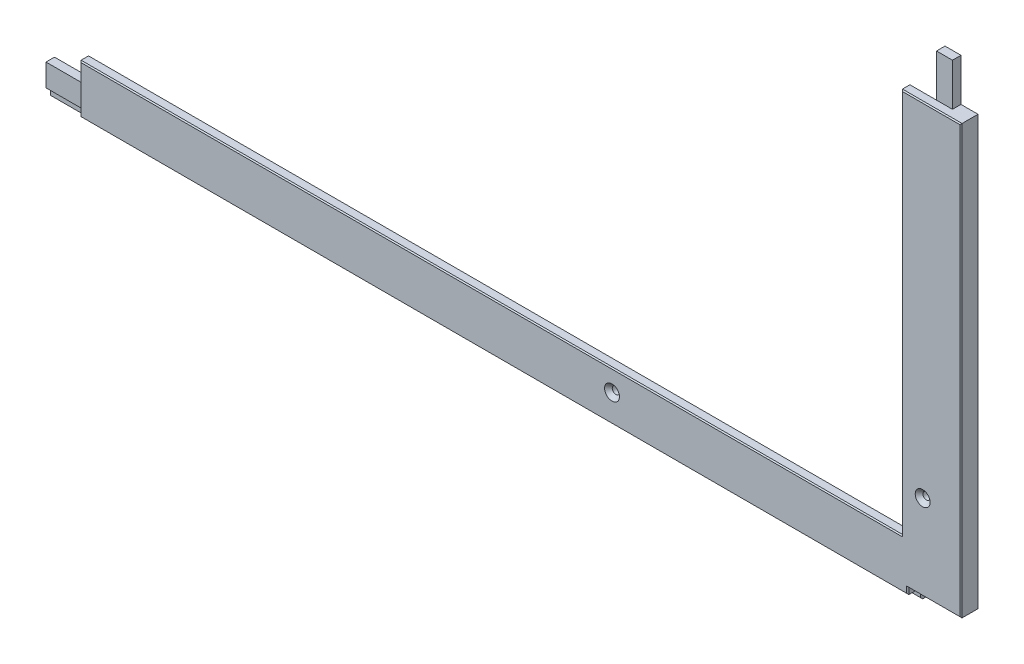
SolidWorks part; units mm, degrees
ref_plane "Ebene vorne" through (0, 0, 0) normal (0, 0, 1) x (1, 0, 0)
ref_plane "Ebene oben" through (0, 0, 0) normal (0, 1, 0) x (1, 0, 0)
ref_plane "Ebene rechts" through (0, 0, 0) normal (1, 0, 0) x (0, 0, -1)
sketch "Skizze1" plane through (0, 0, 0) normal (0, 0, 1) x (1, 0, 0)
  line L1 (-396, -191.25) -> (396, -191.25)
  line L2 (-396, -191.25) -> (-396, 191.25)
  line L3 (-396, 191.25) -> (396, 191.25)
  line L4 (396, -191.25) -> (396, 191.25)
  line L5 (-396, -191.25) -> (396, 191.25) construction
  line L6 (-396, 191.25) -> (396, -191.25) construction
  line L7 (-416, -211.25) -> (416, -211.25)
  line L8 (-416, -211.25) -> (-416, 211.25)
  line L9 (-416, 211.25) -> (416, 211.25)
  line L10 (416, -211.25) -> (416, 211.25)
  line L11 (-416, -211.25) -> (416, 211.25) construction
  line L12 (-416, 211.25) -> (416, -211.25) construction
  point P0 (0, 0)
  point P6 (0, 0)
  dimension "D1" = 832
  dimension "D2" = 422.5
  dimension "D3" = 20
  dimension "D4" = 20
extrude "Aufsatz-Linear austragen1" add sketch "Skizze1" along normal blind 8
fillet "Verrundung1" radius 1 3 edges at (-416, 211.25, 4) (-416, -211.25, 4) (416, 211.25, 4)
sketch "Skizze2" plane through (0, 0, 0) normal (0, 0, -1) x (-1, 0, 0)
  line L0 (-416, -211.25) -> (-416, 210.25) construction
  line L1 (-408.5, 203.75) -> (408.5, 203.75)
  line L2 (-408.5, 203.75) -> (-408.5, -203.75)
  line L3 (-408.5, -203.75) -> (408.5, -203.75)
  line L4 (408.5, 203.75) -> (408.5, -203.75)
  line L5 (-415, 211.25) -> (415, 211.25) construction
  line L6 (416, 210.25) -> (416, -210.25) construction
  line L7 (415, -211.25) -> (-416, -211.25) construction
  dimension "D1" = 7.5
  dimension "D2" = 7.5
  dimension "D3" = 7.5
  dimension "D4" = 7.5
extrude "Schnitt-Linear austragen1" cut sketch "Skizze2" against normal blind 4
hole_wizard "Formsenkung für M3 Senkschraube mit Innensechskant1" positions "Skizze3" profile "Skizze4" countersink size "M3" standard "DIN"
sketch "Skizze3" plane through (0, 0, 8) normal (0, 0, 1) x (1, 0, 0)
  line L0 (-416, 210.25) -> (-416, -210.25) construction
  line L1 (416, -211.25) -> (416, 210.25) construction
  line L2 (-415, -211.25) -> (416, -211.25) construction
  line L3 (415, 211.25) -> (-415, 211.25) construction
  point P0 (-260, -201.25)
  point P2 (260, -201.25)
  point P4 (260, 201.25)
  point P6 (-260, 201.25)
  point P8 (406, 171.25)
  point P10 (406, -171.25)
  point P12 (-406, -171.25)
  point P14 (-406, 171.25)
  point P26 (-406, 0)
  point P32 (406, 0)
  point P37 (0, -201.25)
  point P39 (0, 201.25)
  dimension "D1" = 156
  dimension "D2" = 156
  dimension "D3" = 10
  dimension "D4" = 10
  dimension "D5" = 10
  dimension "D6" = 10
  dimension "D7" = 40
  dimension "D8" = 40
sketch "Skizze4" plane through (-260, -201.25, 8) normal (1, 0, 0) x (0, -1, 0)
  line L0 (0, 0) -> (0, 8)
  line L1 (0, 8) -> (1.7, 8)
  line L2 (1.7, 8) -> (1.7, 1.8)
  line L3 (1.7, 1.8) -> (3.5, 0)
  line L5 (3.5, 0) -> (0, 0)
  line L6 (-1.7, 1.8) -> (-3.5, 0) construction
  line L11 (0, -6.35) -> (0, 107.95) construction
  dimension "Bohrerdurchmesser" = 3.4
  dimension "Bohrungstiefe" = 8
  dimension "Senkdurchmesser (Oben)" = 7
  dimension "Senkwinkel (Oben)" = 90
sketch "Skizze5" plane through (0, 0, 0) normal (1, 0, 0) x (0, 0, -1)
  line L0 (-8, 211.25) -> (-8, -10)
  line L1 (-8, -211.25) -> (-8, 210.25) construction
  line L2 (-8, -10) -> (-4, -10)
  line L3 (-4, -10) -> (-4, 10)
  line L4 (-4, 10) -> (0, 10)
  line L5 (0, -211.25) -> (0, 210.25) construction
  line L6 (0, 10) -> (0, 211.25)
  line L7 (0, 211.25) -> (-8, 211.25)
  dimension "D1" = 10
  dimension "D2" = 10
  dimension "D3" = 4
extrude "Schnitt-Linear austragen2" cut sketch "Skizze5" along normal through all
sketch "Skizze6" plane through (0, 0, 0) normal (1, 0, 0) x (0, 0, -1)
  line L0 (-8, 211.25) -> (-8, -10)
  line L1 (-8, -211.25) -> (-8, -10) construction
  line L2 (-8, -10) -> (-4, -10)
  line L3 (-4, -10) -> (-4, 10)
  line L4 (-4, 10) -> (0, 10)
  line L5 (0, -211.25) -> (0, 10) construction
  line L6 (0, 10) -> (0, 211.25)
  line L7 (0, 211.25) -> (-8, 211.25)
  line L8 (-8, 211.25) -> (-8, 204.75) construction
  dimension "D1" = 10
  dimension "D2" = 4
  dimension "D3" = 10
extrude "Schnitt-Linear austragen3" cut sketch "Skizze6" against normal through all
sketch "Skizze7" plane through (0, 0, 0) normal (0, 1, 0) x (1, 0, 0)
  line L9 (-416, -8) -> (-416, 0)
  line L10 (-416, 0) -> (-10, 0)
  line L11 (408.5, 0) -> (-408.5, 0) construction
  line L12 (-10, 0) -> (-10, -4)
  line L13 (396, -4) -> (-396, -4) construction
  line L14 (-10, -4) -> (10, -4)
  line L15 (408.5, -4) -> (-408.5, -4) construction
  line L16 (10, -4) -> (10, -8)
  line L17 (-396, -8) -> (396, -8) construction
  line L18 (10, -8) -> (-416, -8)
  dimension "D1" = 10
  dimension "D2" = 10
extrude "Schnitt-Linear austragen4" cut sketch "Skizze7" against normal through all both and the other way through all
sketch "Skizze8" plane through (0, 0, 0) normal (0, 0, -1) x (-1, 0, 0)
  line L1 (-416, -10) -> (-424, -10)
  line L2 (-416, -10) -> (-416, -211.25)
  line L3 (-416, -211.25) -> (-424, -211.25)
  line L4 (-424, -10) -> (-424, -211.25)
  line L5 (-416, -211.25) -> (-416, 10) construction
  line L6 (10, -211.25) -> (-416, -211.25) construction
  line L7 (-416, -211.25) -> (-416, 10) construction
  line L8 (-408.5, -10) -> (-396, -10) construction
  dimension "D2" = 8
extrude "Aufsatz-Linear austragen2" add sketch "Skizze8" against normal up to surface (8 mm away)
sketch "Skizze9" plane through (0, -211.25, 0) normal (0, -1, 0) x (1, 0, 0)
  line L0 (399, 8) -> (399, 0)
  line L1 (424, 8) -> (424, 0) construction
  line L6 (10, 4) -> (-10, 4)
  line L7 (-10, 4) -> (-10, 0)
  line L8 (-10, 0) -> (424, 0)
  line L9 (424, 0) -> (424, 8)
  line L10 (424, 8) -> (10, 8)
  line L11 (10, 8) -> (10, 4)
  line L12 (10, 4) -> (-10, 4)
  line L13 (-10, 4) -> (-10, 0)
  line L14 (-10, 0) -> (399, 0)
  line L16 (399, 8) -> (10, 8)
  line L17 (10, 8) -> (10, 4)
  dimension "D2" = 25
  dimension "D1" = 0
extrude "Aufsatz-Linear austragen3" add sketch "Skizze9" along normal blind 3
sketch "Skizze10" plane through (0, 0, 0) normal (0, 0, -1) x (-1, 0, 0)
  line L0 (-399, -214.25) -> (-399, -211.25) construction
  line L1 (-399, -212.75) -> (10, -212.75)
  line L2 (-399, -212.75) -> (-399, -214.25)
  line L3 (-399, -214.25) -> (10, -214.25)
  line L4 (10, -212.75) -> (10, -214.25)
extrude "Aufsatz-Linear austragen4" add sketch "Skizze10" along normal blind 1
sketch "Skizze11" plane through (0, -214.25, 0) normal (0, -1, 0) x (1, 0, 0)
  line L6 (399, 0) -> (399, 8) construction
  line L7 (-10, -1) -> (399, -1)
  line L8 (-10, -1) -> (-10, 2)
  line L9 (-10, 2) -> (399, 2)
  line L10 (399, -1) -> (399, 2)
  dimension "D1" = 3
extrude "Aufsatz-Linear austragen5" add sketch "Skizze11" along normal blind 5
chamfer "Fase3" distance 1 angle 45 1 edges at (194.5, -219.25, 2)
chamfer "Fase4" distance 0.5 angle 45 9 edges at (10, -202.75, 8) (203, -191.25, 8) (396, -100.625, 8) (410, -10, 8) (424, -110.625, 8) (411.5, -211.25, 8) (399, -212.75, 8) (204.5, -214.25, 8) (194.5, -219.25, -1)
chamfer "Fase5" distance 1.5 angle 45 1 edges at (194.5, -212.75, 0)
